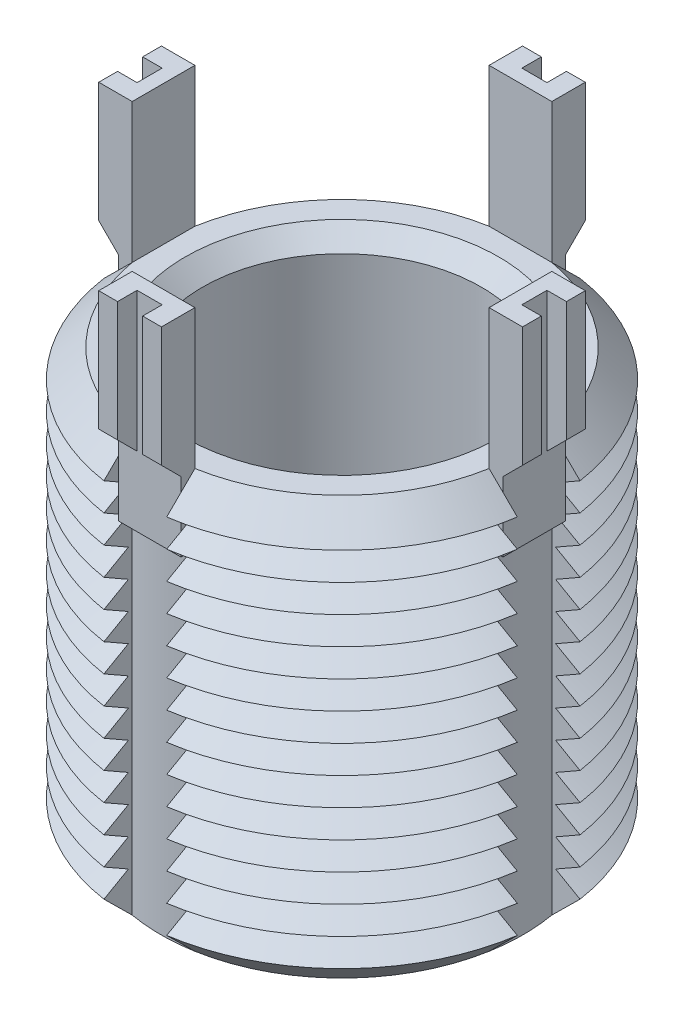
SolidWorks part; units mm, degrees
ref_plane "Front Plane" through (0, 0, 0) normal (0, 0, 1) x (1, 0, 0)
ref_plane "Top Plane" through (0, 0, 0) normal (0, 1, 0) x (1, 0, 0)
ref_plane "Right Plane" through (0, 0, 0) normal (1, 0, 0) x (0, 0, -1)
sketch "Sketch1" plane through (0, 0, 0) normal (0, 1, 0) x (1, 0, 0)
  circle A0 centre (0, 0) radius 15
  dimension "D1" = 30
extrude "Boss-Extrude1" add sketch "Sketch1" against normal blind 30
chamfer "Chamfer1" distance 2 angle 45 2 edges at (0, -30, 15) (0, 0, 15)
sketch "Sketch2" plane through (0, 0, 0) normal (1, 0, 0) x (0, 0, -1)
  line L0 (0, 0.8859) -> (0, -9.2617) construction
sketch "Sketch3" plane through (0, 0, 0) normal (1, 0, 0) x (0, 0, -1)
  line L0 (-15, -2) -> (-13.2679, -3)
  line L1 (-13.2679, -3) -> (-15, -4)
  line L2 (-15, -2) -> (-15, -28) construction
  line L3 (-15, -4) -> (-15, -2)
  dimension "D1" = 2
revolve "Cut-Revolve1" cut sketch "Sketch3" angle 360 about L0
pattern_linear "LPattern1" count 13 spacing 2 along (0, -1, 0) of "Cut-Revolve1"
sketch "Sketch4" plane through (0, 0, 0) normal (0, 1, 0) x (1, 0, 0)
  line L0 (-12.8038, 2.25) -> (-14.8303, 2.25)
  line L2 (-14.8303, -2.25) -> (-12.8038, -2.25)
  arc A0 (-12.8038, 2.25) -> (-12.8038, -2.25) centre (0, 0) ccw
  arc A1 (-14.8303, 2.25) -> (-14.8303, -2.25) centre (0, 0) ccw
  circle A2 centre (0, 0) radius 15 construction
  circle A3 centre (0, 0) radius 13 construction
  point P1 (-13, 0)
  point P3 (-15, 0)
  point P13 (0, 0)
  dimension "D1" = 4.5
extrude "Cut-Extrude1" cut sketch "Sketch4" against normal up to surface (30 mm away)
pattern_circular "CirPattern1" count 4 over 360 about axis through (0, 0, 0) along (0, 1, 0) of "Cut-Extrude1"
sketch "Sketch5" plane through (0, 0, 0) normal (1, 0, 0) x (0, 0, -1)
  line L0 (-12.8038, 10) -> (-12.8038, -5)
  line L1 (-12.8038, -5) -> (-13.8038, -5)
  line L2 (-13.8038, -5) -> (-13.8038, 0)
  line L3 (-13.8038, 0) -> (-15.2038, 1.4)
  line L4 (-15.2038, 1.4) -> (-15.2038, 10)
  line L5 (-15.2038, 10) -> (-12.8038, 10)
  line L6 (-14.8303, -6) -> (-2.25, -6) construction
  point P9 (-2.25, 0)
  point P10 (-13.8038, 0)
  dimension "D1" = 1
  dimension "D2" = 15
  dimension "D3" = 10
  dimension "D4" = 2.4
  dimension "D5" = 1
  dimension "D6" = 45
extrude "Boss-Extrude3" add sketch "Sketch5" along normal mid plane 4.5
pattern_circular "CirPattern2" count 4 over 360 about axis through (0, 0, 0) along (0, 1, 0) of "Boss-Extrude3"
sketch "Sketch6" plane through (0, 10, 0) normal (0, 1, 0) x (1, 0, 0)
  line L0 (-15.2038, -2.25) -> (-15.2038, 2.25) construction
  line L1 (-15.2038, -0.9) -> (-13.8038, -0.9)
  line L2 (-15.2038, -0.9) -> (-15.2038, 0.9)
  line L3 (-15.2038, 0.9) -> (-13.8038, 0.9)
  line L4 (-13.8038, -0.9) -> (-13.8038, 0.9)
  line L5 (-15.2038, -0.9) -> (-13.8038, 0.9) construction
  line L6 (-15.2038, 0.9) -> (-13.8038, -0.9) construction
  line L7 (15.2038, 2.25) -> (15.2038, -2.25) construction
  line L8 (-0.9, 13.8038) -> (0.9, 13.8038)
  line L9 (-0.9, 13.8038) -> (-0.9, 15.2038)
  line L10 (-0.9, 15.2038) -> (0.9, 15.2038)
  line L11 (0.9, 13.8038) -> (0.9, 15.2038)
  line L12 (-0.9, 13.8038) -> (0.9, 15.2038) construction
  line L13 (-0.9, 15.2038) -> (0.9, 13.8038) construction
  line L14 (13.8038, -0.9) -> (15.2038, -0.9)
  line L15 (13.8038, -0.9) -> (13.8038, 0.9)
  line L16 (13.8038, 0.9) -> (15.2038, 0.9)
  line L17 (15.2038, -0.9) -> (15.2038, 0.9)
  line L18 (13.8038, -0.9) -> (15.2038, 0.9) construction
  line L19 (13.8038, 0.9) -> (15.2038, -0.9) construction
  line L20 (-0.9, -15.2038) -> (0.9, -15.2038)
  line L21 (-0.9, -15.2038) -> (-0.9, -13.8038)
  line L22 (-0.9, -13.8038) -> (0.9, -13.8038)
  line L23 (0.9, -15.2038) -> (0.9, -13.8038)
  line L24 (-0.9, -15.2038) -> (0.9, -13.8038) construction
  line L25 (-0.9, -13.8038) -> (0.9, -15.2038) construction
  line L26 (-2.25, 15.2038) -> (2.25, 15.2038) construction
  line L27 (2.25, -15.2038) -> (-2.25, -15.2038) construction
  point P0 (-14.5038, 0)
  point P7 (-15.2038, 0)
  point P8 (-15.2038, 0)
  point P9 (0, 14.5038)
  point P14 (14.5038, 0)
  point P19 (0, -14.5038)
  point P24 (0, 15.2038)
  point P25 (15.2038, 0)
  point P26 (15.2038, 0)
  point P27 (0, 15.2038)
  point P30 (0, -15.2038)
  point P33 (0, -15.2038)
  dimension "D1" = 1.8
  dimension "D2" = 1.4
extrude "Cut-Extrude3" cut sketch "Sketch6" against normal through all both and the other way through all
sketch "Sketch7" plane through (0, 0, 0) normal (0, 1, 0) x (1, 0, 0)
  circle A0 centre (0, 0) radius 10
  dimension "D1" = 20
extrude "Cut-Extrude4" cut sketch "Sketch7" against normal up to surface (30 mm away)
chamfer "Chamfer2" distance 1.25 angle 45 2 edges at (0, 0, 10) (0, -30, 10)
